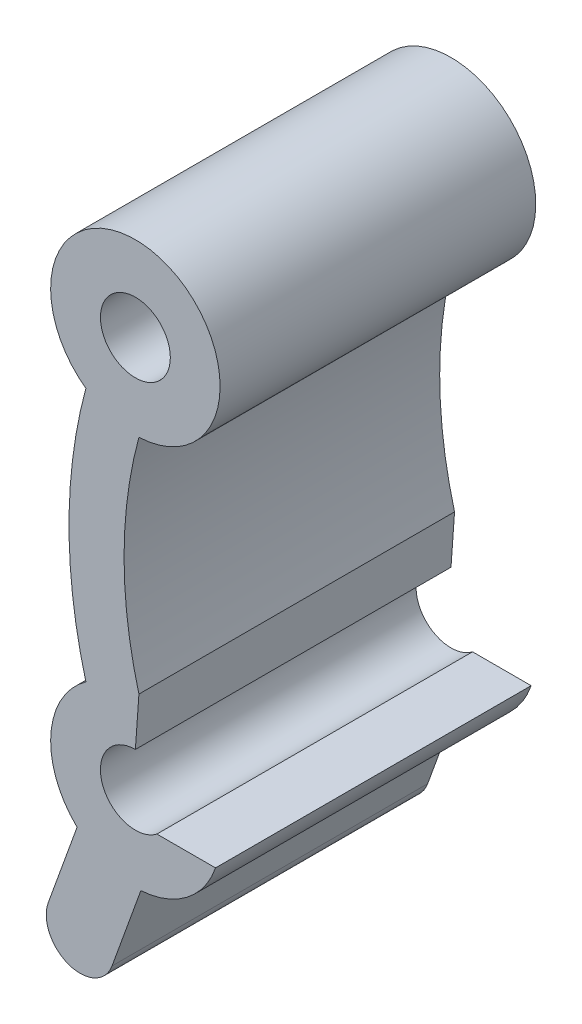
SolidWorks part; units mm, degrees
ref_plane "Płaszczyzna przednia" through (0, 0, 0) normal (0, 0, 1) x (1, 0, 0)
ref_plane "Płaszczyzna górna" through (0, 0, 0) normal (0, 1, 0) x (1, 0, 0)
ref_plane "Płaszczyzna prawa" through (0, 0, 0) normal (1, 0, 0) x (0, 0, -1)
sketch "Szkic1" plane through (0, 0, 0) normal (0, 0, 1) x (1, 0, 0)
  line L0 (152.7111, 44.75) -> (152.5443, 42.4035)
  line L1 (156.3272, 39.4535) -> (153.5604, 39.4535)
  line L2 (149.7928, 37.8501) -> (148.4324, 34.0886)
  line L4 (151.4416, 33.0002) -> (152.8021, 36.7618)
  arc A0 (152.7111, 55.25) -> (150.2076, 56) centre (152.5443, 59.2465) ccw
  arc A3 (150.2076, 44) -> (149.7928, 37.8501) centre (152.5443, 40.7535) ccw
  circle A4 centre (152.5443, 59.2465) radius 1.65
  arc A5 (152.5443, 42.4035) -> (153.5604, 39.4535) centre (152.5443, 40.7535) ccw
  arc A8 (148.4324, 34.0886) -> (151.4416, 33.0002) centre (149.937, 33.5444) ccw
  arc A9 (150.2076, 56) -> (150.2076, 44) centre (172.4112, 50) ccw
  arc A10 (152.7111, 55.25) -> (152.7111, 44.75) centre (172.0098, 50) ccw
  arc A11 (152.8021, 36.7618) -> (156.3272, 39.4535) centre (152.5443, 40.7535) ccw
  dimension "D1" = 4
  dimension "D2" = 23
  dimension "D3" = 20
  dimension "D5" = 3.3
  dimension "D6" = 1.65
  dimension "D7" = 4
  dimension "D4" = 4
  dimension "D8" = 12
  dimension "D9" = 10.5
extrude "Dodanie-wyciągnięcie1" add sketch "Szkic1" along normal mid plane 14.9
